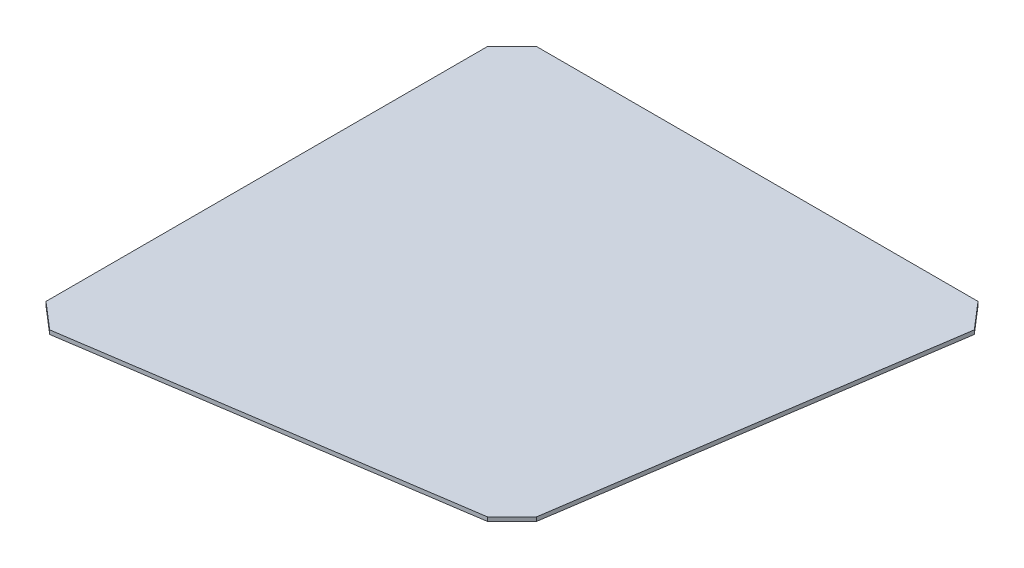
SolidWorks part; units mm, degrees
ref_plane "Front Plane" through (0, 0, 0) normal (0, 0, 1) x (1, 0, 0)
ref_plane "Top Plane" through (0, 0, 0) normal (0, 1, 0) x (1, 0, 0)
ref_plane "Right Plane" through (0, 0, 0) normal (1, 0, 0) x (0, 0, -1)
sketch "Sketch2" plane through (0, 884.5296, 0) normal (0, 1, 0) x (1, 0, 0)
  line L0 (0, 0) -> (0, -1212.85) construction
  line L1 (4.3656, -1217.2156) -> (1217.2156, -1217.2156)
  line L2 (4.3656, -1217.2156) -> (4.3656, -4.3656)
  line L3 (4.3656, -4.3656) -> (1217.2156, -4.3656)
  line L4 (1217.2156, -1217.2156) -> (1217.2156, -4.3656)
  line L5 (0, 0) -> (1212.85, 0) construction
  dimension "D1" = 1212.85
extrude "Boss-Extrude1" add sketch "Sketch2" against normal blind 8.7312
ref_plane "Plane1" through (173.4971, 173.4971, 1160.1465) normal (-0.1463, -0.1463, -0.9784) x (0.0216, -0.9892, 0.1447)
ref_plane "Plane2" through (1160.1465, 173.4971, 173.4971) normal (-0.9784, -0.1463, -0.1463) x (-0.1447, -0.0216, 0.9892)
other "SurfaceCut1"
other "SurfaceCut2"
sketch "Sketch3" plane through (4.3656, 0, 0) normal (-1, 0, 0) x (0, 0, 1)
  line L1 (1079.1065, 884.5296) -> (1080.4123, 884.5296)
  line L2 (1079.1065, 884.5296) -> (1079.1065, 875.7983)
  line L3 (1079.1065, 875.7983) -> (1080.4123, 875.7983)
  line L4 (1080.4123, 884.5296) -> (1080.4123, 875.7983)
extrude "Cut-Extrude1" cut sketch "Sketch3" along direction (0.989, 0, -0.1479) on the side against the normal through all
sketch "Sketch4" plane through (0, 0, 4.3656) normal (0, 0, -1) x (-1, 0, 0)
  line L1 (-1080.4123, 875.7983) -> (-1079.1065, 875.7983)
  line L2 (-1080.4123, 875.7983) -> (-1080.4123, 884.5296)
  line L3 (-1080.4123, 884.5296) -> (-1079.1065, 884.5296)
  line L4 (-1079.1065, 875.7983) -> (-1079.1065, 884.5296)
extrude "Cut-Extrude2" cut sketch "Sketch4" along direction (0.1479, 0, -0.989) on the side against the normal through all
sketch "Sketch5" plane through (0, 884.5296, 0) normal (0, 1, 0) x (1, 0, 0)
  line L0 (4.3656, -58.2472) -> (58.2472, -4.3656)
  line L1 (4.3656, -1020.7358) -> (62.0944, -1070.4733)
  line L2 (892.4188, -946.3003) -> (946.3003, -892.4188)
  line L3 (1020.7358, -4.3656) -> (1070.4733, -62.0944)
  line L4 (939.2907, -939.2907) -> (1079.1065, -4.3656)
  line L5 (4.3656, -1079.1065) -> (939.2907, -939.2907)
  line L6 (4.3656, -4.3656) -> (4.3656, -1079.1065)
  line L7 (1079.1065, -4.3656) -> (4.3656, -4.3656)
  line L8 (939.2907, -939.2907) -> (946.3003, -892.4188)
  line L9 (4.3656, -1079.1065) -> (62.0944, -1070.4733)
  line L10 (4.3656, -4.3656) -> (4.3656, -58.2472)
  line L11 (1079.1065, -4.3656) -> (1020.7358, -4.3656)
  line L12 (4.3656, -1020.7358) -> (4.3656, -1079.1065)
  line L13 (1070.4733, -62.0944) -> (1079.1065, -4.3656)
  line L14 (58.2472, -4.3656) -> (4.3656, -4.3656)
  line L15 (892.4188, -946.3003) -> (939.2907, -939.2907)
  dimension "D2" = 76.2
  dimension "D1" = 0
extrude "Cut-Extrude3" cut sketch "Sketch5" against normal through all
